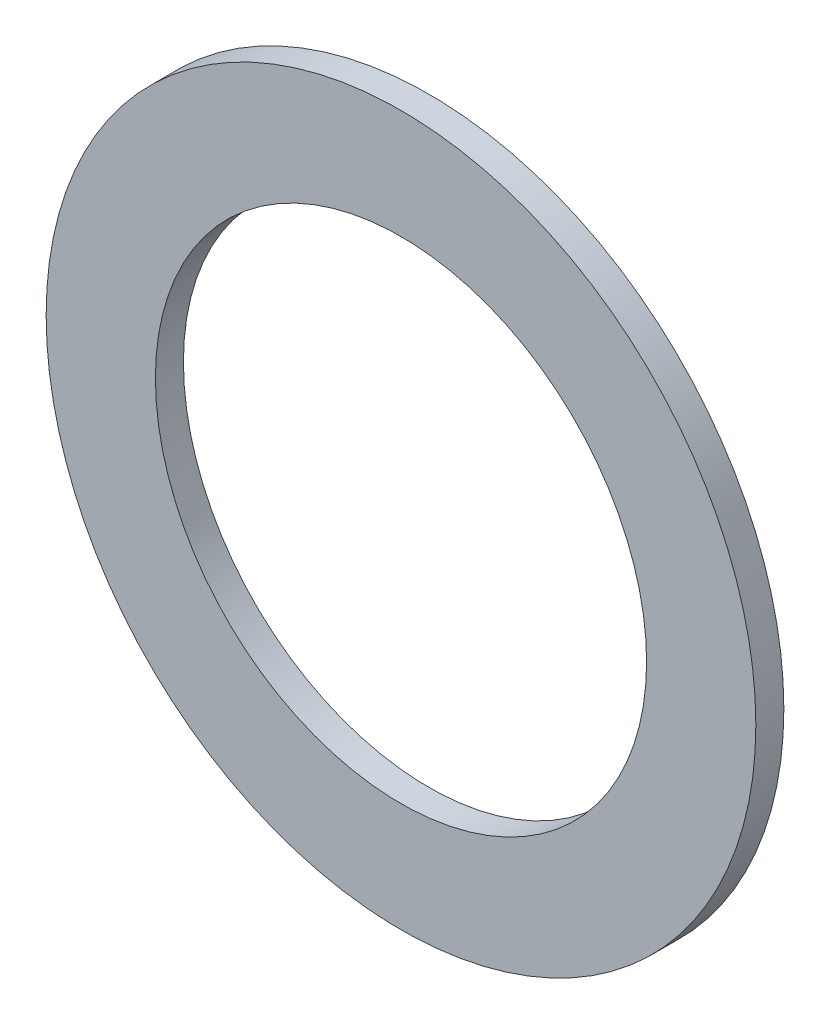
SolidWorks part; units mm, degrees
ref_plane "Plan1" through (0, 0, 0) normal (0, 0, 1) x (1, 0, 0)
ref_plane "Plan2" through (0, 0, 0) normal (0, 1, 0) x (1, 0, 0)
ref_plane "Plan3" through (0, 0, 0) normal (1, 0, 0) x (0, 0, -1)
sketch "Esquisse1" plane through (0, 0, 0) normal (0, 0, 1) x (1, 0, 0)
  circle A0 centre (0, 0) radius 19
  circle A1 centre (0, 0) radius 13.15
  dimension "D1" = 38
  dimension "D2" = 26.3
extrude "Base-Extrusion" add sketch "Esquisse1" along normal blind 1.5
